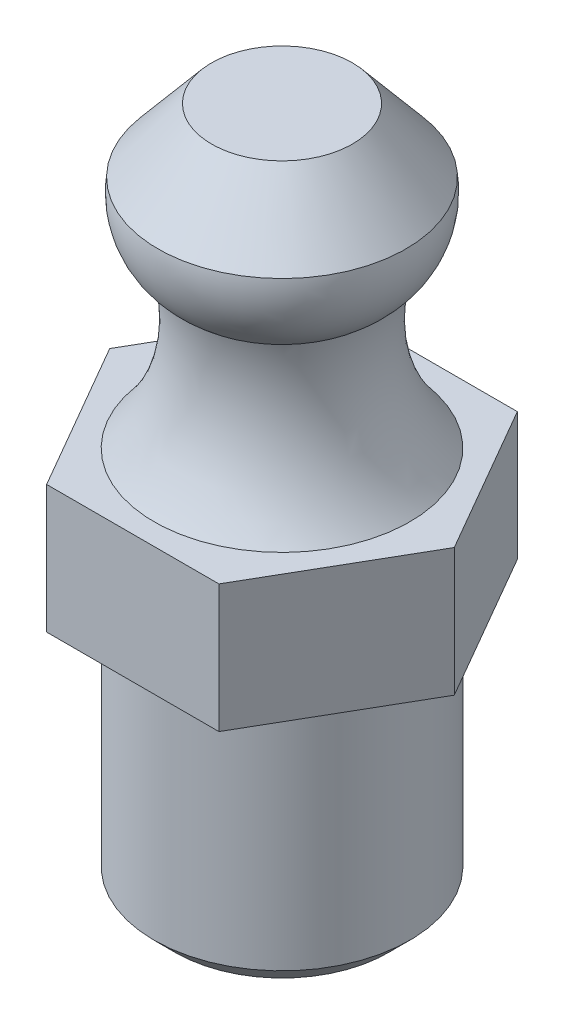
SolidWorks part; units mm, degrees
ref_plane "Plan de face" through (0, 0, 0) normal (0, 0, 1) x (1, 0, 0)
ref_plane "Plan de dessus" through (0, 0, 0) normal (0, 1, 0) x (1, 0, 0)
ref_plane "Plan de droite" through (0, 0, 0) normal (1, 0, 0) x (0, 0, -1)
sketch "Esquisse1" plane through (0, 0, 0) normal (0, 1, 0) x (1, 0, 0)
  circle A0 centre (0, 0) radius 3
  dimension "D1" = 6
extrude "Extrusion1" add sketch "Esquisse1" against normal blind 6
sketch "Esquisse2" plane through (0, 0, 0) normal (0, 1, 0) x (-1, 0, 0)
  line L1 (-2.0207, 3.5) -> (-4.0415, 0)
  line L2 (-4.0415, 0) -> (-2.0207, -3.5)
  line L3 (-2.0207, -3.5) -> (2.0207, -3.5)
  line L4 (2.0207, -3.5) -> (4.0415, 0)
  line L5 (4.0415, 0) -> (2.0207, 3.5)
  line L6 (2.0207, 3.5) -> (-2.0207, 3.5)
  circle A0 centre (0, 0) radius 3.5 construction
  dimension "D1" = 7
extrude "Extrusion2" add sketch "Esquisse2" along normal blind 3
sketch "Esquisse3" plane through (0, 0, 0) normal (0, 0, 1) x (1, 0, 0)
  line L0 (0, 0) -> (0, 12.8082) construction
  line L1 (0, 10) -> (-1.6519, 10)
  line L2 (-1.6519, 10) -> (-2.9106, 8.5)
  line L3 (-4.0415, 3) -> (-2.0207, 3) construction
  line L4 (-3, 3) -> (0, 3)
  line L5 (0, 3) -> (0, 10)
  line L6 (-3, -6) -> (3, -6) construction
  arc A0 (-2.9106, 8.5) -> (-2.1585, 6.6272) centre (-0.9322, 8.207) ccw
  arc A1 (-2.1585, 6.6272) -> (-3, 3) centre (-6.028, 5.6136) cw
  dimension "D4" = 2
  dimension "D5" = 4
  dimension "D1" = 16
  dimension "D2" = 130
  dimension "D3" = 1.5
  dimension "D6" = 3
revolve "Révolution1" add sketch "Esquisse3" angle 360 about L0
chamfer "Chanfrein1" distance 0.5 angle 45 1 edges at (0, -6, 3)
